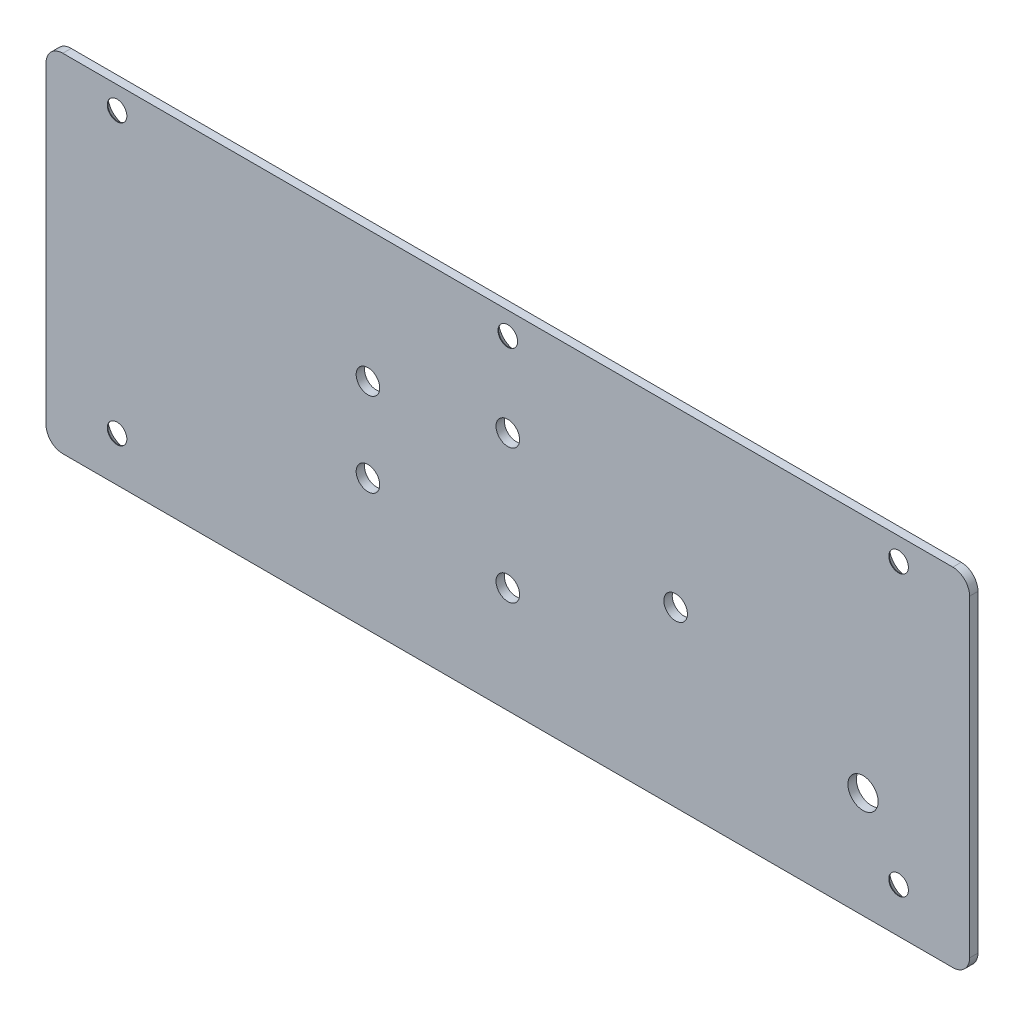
SolidWorks part; units mm, degrees
ref_plane "Front Plane" through (0, 0, 0) normal (0, 0, 1) x (1, 0, 0)
ref_plane "Top Plane" through (0, 0, 0) normal (0, 1, 0) x (1, 0, 0)
ref_plane "Right Plane" through (0, 0, 0) normal (1, 0, 0) x (0, 0, -1)
sketch "Sketch1" plane through (0, 0, 0) normal (1, 0, 0) x (0, 0, -1)
  line L0 (0.825, 0) -> (-0.825, 0) construction
  line L1 (0, 0) -> (0, 62)
  line L2 (0, 34.925) -> (0, -34.925) construction
  point P6 (0, 0)
  dimension "D1" = 62
extrude "Extrude-Thin1" add sketch "Sketch1" against normal blind 165.1 thin
sketch "Sketch3" plane through (0, 0, 0) normal (0, 0, -1) x (-1, 0, 0)
  line L0 (82.55, 43) -> (82.55, 19) construction
  line L1 (165.1, 0) -> (0, 0) construction
  line L3 (82.55, 19) -> (82.55, 0) construction
  line L5 (82.55, 43) -> (82.55, 62) construction
  line L6 (165.1, 62) -> (0, 62) construction
  line L9 (52.55, 31) -> (82.55, 31) construction
  line L10 (107.55, 38.5) -> (107.55, 23.5) construction
  line L11 (107.55, 31) -> (82.55, 31) construction
  circle A1 centre (82.55, 43) radius 2.1082
  circle A3 centre (82.55, 19) radius 2.1082
  circle A8 centre (107.55, 38.5) radius 2.1082
  circle A9 centre (107.55, 23.5) radius 2.1082
  circle A10 centre (52.55, 31) radius 2.1082
  dimension "D1" = 4.2164
  dimension "D2" = 24
  dimension "D3" = 30
  dimension "D4" = 15
  dimension "D5" = 25
extrude "Cut-Extrude2" cut sketch "Sketch3" against normal through all
sketch "Sketch4" plane through (0, 0, 1.5) normal (0, 0, 1) x (1, 0, 0)
  line L0 (-82.55, 58) -> (-82.55, 62) construction
  line L1 (-152.4, 58) -> (-12.7, 58) construction
  line L2 (-152.4, 58) -> (-152.4, 8) construction
  line L3 (-152.4, 8) -> (-12.7, 8) construction
  line L4 (-12.7, 58) -> (-12.7, 8) construction
  line L5 (-165.1, 62) -> (0, 62) construction
  line L7 (-165.1, 0) -> (0, 0) construction
  circle A0 centre (-152.4, 58) radius 1.75
  circle A1 centre (-12.7, 58) radius 1.75
  circle A2 centre (-12.7, 8) radius 1.75
  circle A3 centre (-152.4, 8) radius 1.75
  circle A4 centre (-82.55, 58) radius 1.75
  dimension "D2" = 3.5
  dimension "D1" = 139.7
  dimension "D3" = 4
  dimension "D4" = 8
extrude "Cut-Extrude3" cut sketch "Sketch4" against normal through all
sketch "Sketch5" plane through (0, 0, 0) normal (0, 0, -1) x (-1, 0, 0)
  line L0 (82.55, 19) -> (19.05, 19) construction
  circle A0 centre (19.05, 19) radius 2.7
  dimension "D1" = 5.4
  dimension "D2" = 63.5
extrude "Cut-Extrude4" cut sketch "Sketch5" against normal up to next
sketch "Sketch6" plane through (0, 0, 0) normal (0, 0, -1) x (-1, 0, 0)
  circle A0 centre (19.05, 19) radius 5
  circle A1 centre (19.05, 19) radius 2.7 construction
  circle A2 centre (19.05, 19) radius 2.7
  dimension "D1" = 10
extrude "Boss-Extrude1" add sketch "Sketch6" along normal blind 0.01
chamfer "Chamfer1" distance 1.4 angle 45 5 edges at (-150.65, 58, 0) (-150.65, 8, 0) (-10.95, 8, 0) (-10.95, 58, 0) (-80.8, 58, 0)
fillet "Fillet1" radius 3 4 edges at (-165.1, 62, 0.75) (-165.1, 0, 0.75) (0, 0, 0.75) (0, 62, 0.75)
